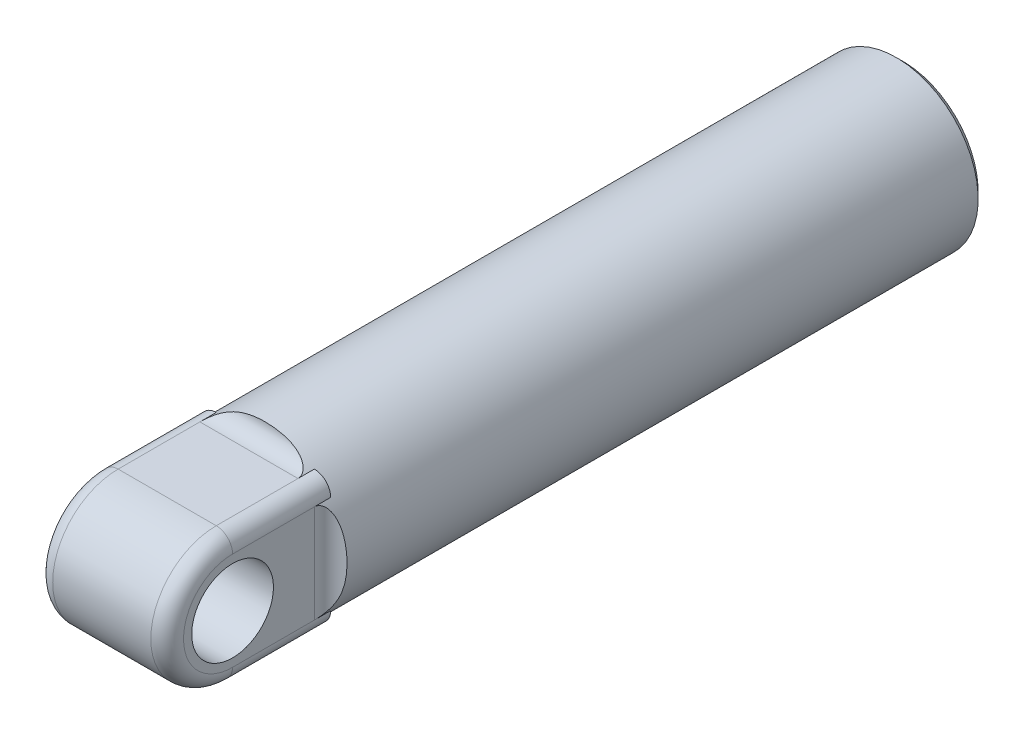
SolidWorks part; units mm, degrees
ref_plane "Ebene vorne" through (0, 0, 0) normal (0, 0, 1) x (1, 0, 0)
ref_plane "Ebene oben" through (0, 0, 0) normal (0, 1, 0) x (1, 0, 0)
ref_plane "Ebene rechts" through (0, 0, 0) normal (1, 0, 0) x (0, 0, -1)
sketch "Skizze6" plane through (0, 0, 0) normal (1, 0, 0) x (0, 0, -1)
  line L0 (0, 40) -> (60, 40)
  line L1 (60, 40) -> (60, -40)
  line L2 (60, -40) -> (0, -40)
  circle A0 centre (0, 0) radius 25
  arc A1 (0, 40) -> (0, -40) centre (0, 0) ccw
  point P6 (0, 0)
  dimension "D1" = 50
  dimension "D2" = 15
  dimension "D3" = 60
extrude "Aufsatz-Linear austragen2" add sketch "Skizze6" along normal mid plane 80
fillet "Verrundung2" radius 10 6 edges at (40, 40, -30) (40, -40, -30) (-40, -40, -30) (-40, 0, 40) (40, 0, 40) (-40, 40, -30)
sketch "Skizze7" plane through (0, 0, -60) normal (0, 0, -1) x (-1, 0, 0)
  circle A0 centre (0, 0) radius 50
  dimension "D1" = 100
extrude "Aufsatz-Linear austragen3" add sketch "Skizze7" along normal blind 390
fillet "Verrundung3" radius 10 4 edges at (40, 0, -60) (0, -40, -60) (-40, 0, -60) (0, 40, -60)
chamfer "Fase2" distance 4 angle 45 1 edges at (-50, 0, -450)
sketch "Skizze8" plane through (0, 0, -450) normal (0, 0, -1) x (-1, 0, 0)
  circle A0 centre (0, 0) radius 28
  dimension "D1" = 56
extrude "Schnitt-Linear austragen5" cut sketch "Skizze8" against normal blind 382
